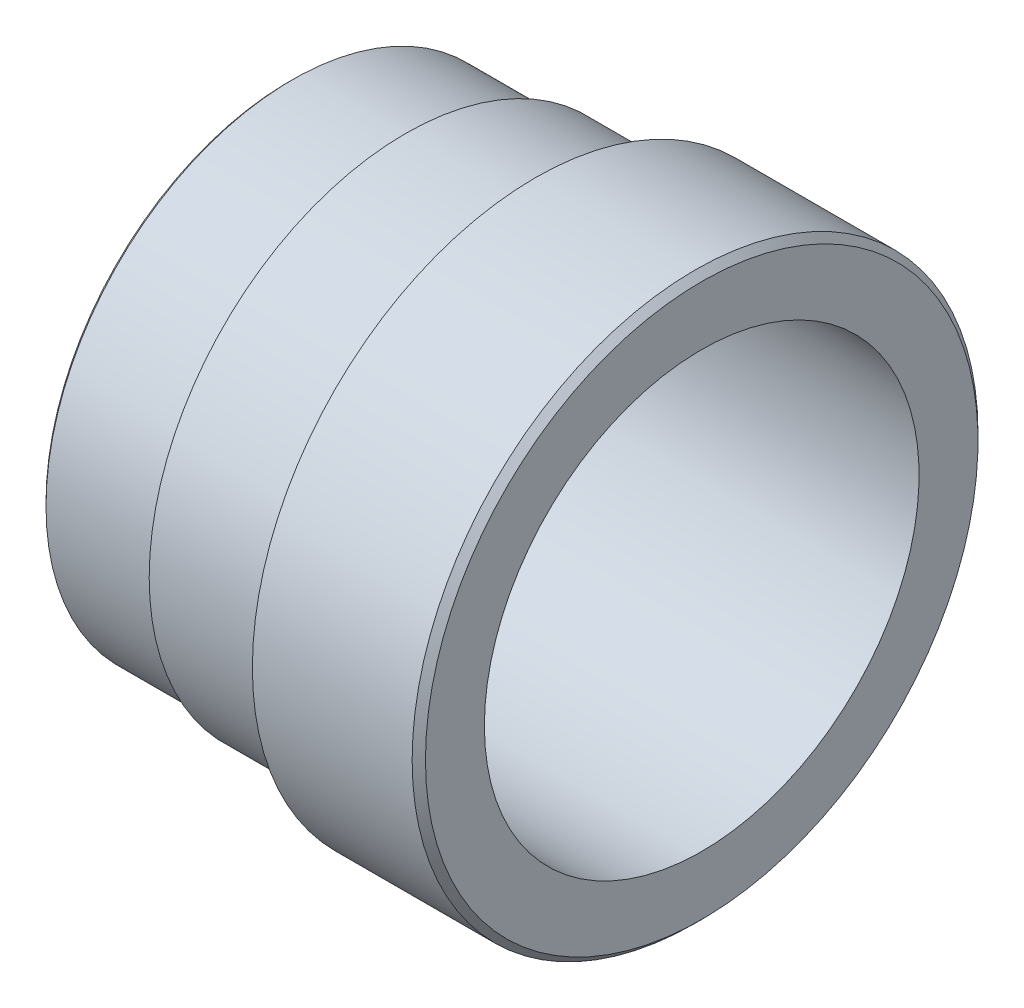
SolidWorks part; units mm, degrees
ref_plane "Plan de face" through (0, 0, 0) normal (0, 0, 1) x (1, 0, 0)
ref_plane "Plan de dessus" through (0, 0, 0) normal (0, 1, 0) x (1, 0, 0)
ref_plane "Plan de droite" through (0, 0, 0) normal (1, 0, 0) x (0, 0, -1)
sketch "Esquisse1" plane through (0, 0, 0) normal (0, 0, 1) x (1, 0, 0)
  line L0 (0, 65.3) -> (0, 83)
  line L1 (0, 83) -> (-2, 85)
  line L2 (-2, 85) -> (-50, 85)
  line L3 (-50, 85) -> (-50, 79)
  line L4 (-52, 77) -> (-89, 77)
  line L5 (-89, 77) -> (-89, 74)
  line L6 (-89, 74) -> (-123, 74)
  line L7 (-124, 73) -> (-124, 65.3)
  line L8 (-124, 0) -> (0, 0) construction
  line L9 (-123, 74) -> (-124, 73)
  line L10 (-124, 65.3) -> (0, 65.3)
  arc A0 (-50, 79) -> (-52, 77) centre (-52, 79) cw
  point P9 (-124, 74)
  dimension "D5" = 2
  dimension "D1" = 85
  dimension "D2" = 2
  dimension "D3" = 2
  dimension "D4" = 50
  dimension "D6" = 77
  dimension "D7" = 39
  dimension "D8" = 74
  dimension "D9" = 35
  dimension "D12" = 1
  dimension "D10" = 65.3
revolve "Révolution1" add sketch "Esquisse1" angle 360 about L8
